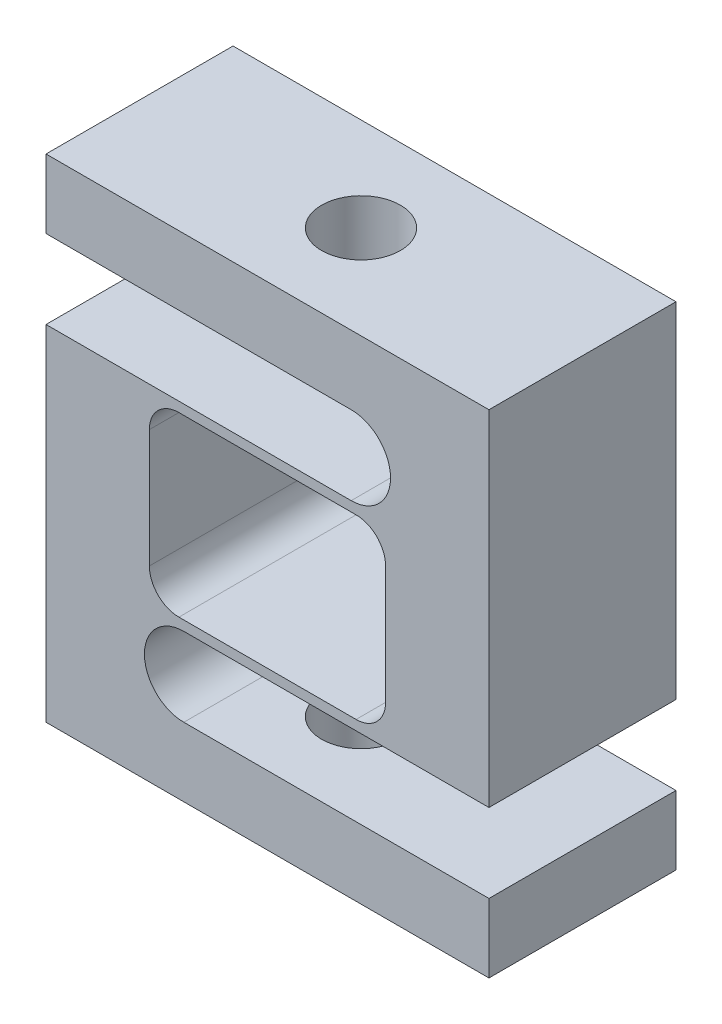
SolidWorks part; units mm, degrees
ref_plane "Face" through (0, 0, 0) normal (0, 0, 1) x (1, 0, 0)
ref_plane "Dessus" through (0, 0, 0) normal (0, 1, 0) x (1, 0, 0)
ref_plane "Droite" through (0, 0, 0) normal (1, 0, 0) x (0, 0, -1)
sketch "Esquisse1" plane through (0, 0, 0) normal (0, 0, 1) x (1, 0, 0)
  line L0 (-22.5, 18) -> (8.5, 18)
  line L1 (-22.5, 25) -> (22.5, 25)
  line L2 (-22.5, 25) -> (-22.5, 18)
  line L3 (-22.5, -25) -> (22.5, -25)
  line L4 (22.5, 25) -> (22.5, -10)
  line L5 (-12, 9) -> (12, 9)
  line L6 (-12, 9) -> (-12, -9)
  line L7 (-12, -9) -> (12, -9)
  line L8 (12, 9) -> (12, -9)
  line L9 (8.5, 10) -> (-22.5, 10)
  line L10 (50, 0) -> (-50, 0) construction
  line L11 (0, -50) -> (0, 50) construction
  line L12 (-22.5, 10) -> (-22.5, -25)
  line L13 (22.5, -10) -> (-8.5, -10)
  line L14 (-8.5, -18) -> (22.5, -18)
  line L15 (22.5, -18) -> (22.5, -25)
  arc A0 (8.5, 18) -> (8.5, 10) centre (8.5, 14) cw
  arc A1 (-8.5, -10) -> (-8.5, -18) centre (-8.5, -14) ccw
  dimension "D1" = 45
  dimension "D2" = 50
  dimension "D3" = 25
  dimension "D4" = 22.5
  dimension "D5" = 18
  dimension "D6" = 9
  dimension "D7" = 24
  dimension "D8" = 12
  dimension "D9" = 7
  dimension "D10" = 8
  dimension "D11" = 31
  dimension "D12" = 31
  dimension "D13" = 7
  dimension "D14" = 8
  dimension "D15" = 31
extrude "Boss.-Extru.1" add sketch "Esquisse1" along normal mid plane 19
sketch "Esquisse2" plane through (0, 25, 0) normal (0, 1, 0) x (1, 0, 0)
  circle A0 centre (0, 0) radius 4
extrude "Enlèv. mat.-Extru.2" cut sketch "Esquisse2" against normal up to next
sketch "Esquisse4" plane through (0, -25, 0) normal (0, -1, 0) x (1, 0, 0)
  circle A0 centre (0, 0) radius 4
extrude "Enlèv. mat.-Extru.3" cut sketch "Esquisse4" against normal up to next
fillet "Congé1" radius 3 4 edges at (-12, 9, 0) (12, 9, 0) (-12, -9, 0) (12, -9, 0)
